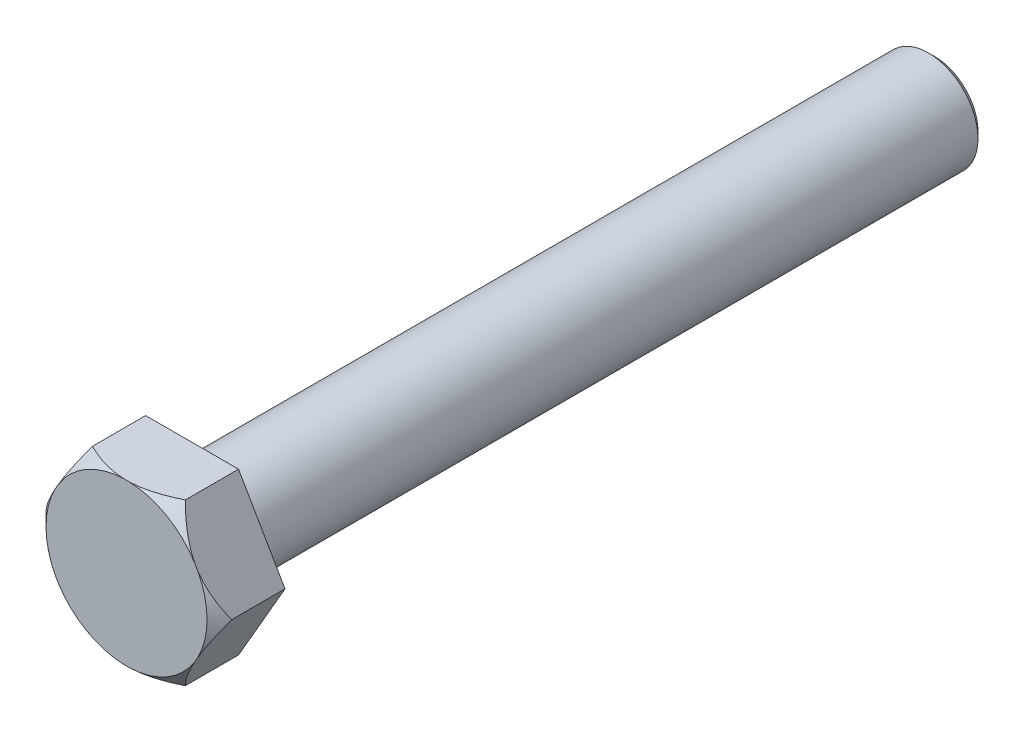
SolidWorks part; units mm, degrees
ref_plane "Plan de face" through (0, 0, 0) normal (0, 0, 1) x (1, 0, 0)
ref_plane "Plan de dessus" through (0, 0, 0) normal (0, 1, 0) x (1, 0, 0)
ref_plane "Plan de droite" through (0, 0, 0) normal (1, 0, 0) x (0, 0, -1)
sketch "Esquisse1" plane through (0, 0, 0) normal (0, 0, 1) x (1, 0, 0)
  line L1 (7.5056, 0) -> (3.7528, 6.5)
  line L2 (3.7528, 6.5) -> (-3.7528, 6.5)
  line L3 (-3.7528, 6.5) -> (-7.5056, 0)
  line L4 (-7.5056, 0) -> (-3.7528, -6.5)
  line L5 (-3.7528, -6.5) -> (3.7528, -6.5)
  line L6 (3.7528, -6.5) -> (7.5056, 0)
  circle A0 centre (0, 0) radius 6.5 construction
  dimension "D1" = 13
extrude "Boss.-Extru.1" add sketch "Esquisse1" along normal blind 5.3
sketch "Esquisse3" plane through (0, 0, 0) normal (0, 1, 0) x (1, 0, 0)
  line L0 (0, 2.9031) -> (0, -10.4428) construction
  line L1 (-7.5056, -4.3) -> (-6.5056, -5.3)
  line L2 (-9.0249, -6.1429) -> (-6.5056, -6.1429)
  line L3 (-9.0249, -6.1429) -> (-9.0249, -4.3)
  line L4 (-9.0249, -4.3) -> (-7.5056, -4.3)
  line L5 (-6.5056, -6.1429) -> (-6.5056, -5.3)
  line L6 (-7.5056, -5.3) -> (-7.5056, 0) construction
  line L8 (-3.7528, -5.3) -> (-7.5056, -5.3) construction
  dimension "D1" = 1
  dimension "D2" = 1
revolve "Enlèvement de matière-Révolution2" cut sketch "Esquisse3" angle 360 about L0
sketch "Esquisse4" plane through (0, 0, 0) normal (1, 0, 0) x (0, 0, -1)
  line L0 (0, 0) -> (83.8832, 0) construction
  line L1 (0, -4) -> (59.5, -4)
  line L2 (0, -6.5) -> (0, 0) construction
  line L3 (60, -3.5) -> (60, 0)
  line L4 (59.5, -4) -> (60, -3.5)
  line L5 (0, -4) -> (0, 0)
  line L6 (0, 0) -> (60, 0)
  point P4 (60, -4)
  dimension "D1" = 4
  dimension "D2" = 60
  dimension "D6" = 0.5
revolve "Révolution2" add sketch "Esquisse4" angle 360 about L0
